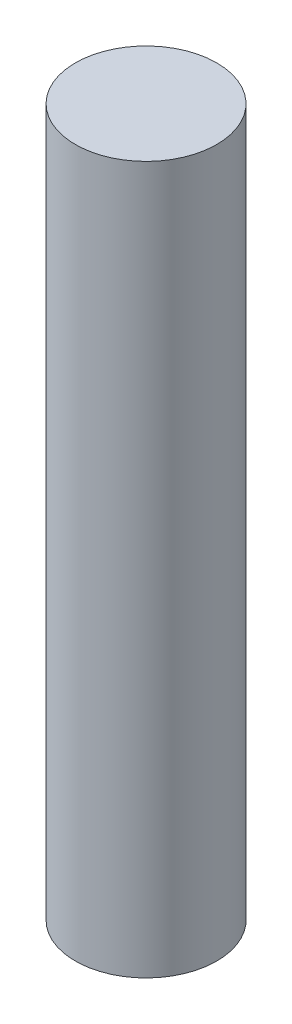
SolidWorks part; units mm, degrees
ref_plane "Front Plane" through (0, 0, 0) normal (0, 0, 1) x (1, 0, 0)
ref_plane "Top Plane" through (0, 0, 0) normal (0, 1, 0) x (1, 0, 0)
ref_plane "Right Plane" through (0, 0, 0) normal (1, 0, 0) x (0, 0, -1)
sketch "Sketch2" plane through (0, 0, 0) normal (0, 1, 0) x (1, 0, 0)
  circle A0 centre (0, 0) radius 3.81
  dimension "D1" = 7.62
extrude "Boss-Extrude1" add sketch "Sketch2" along normal mid plane 38.1
